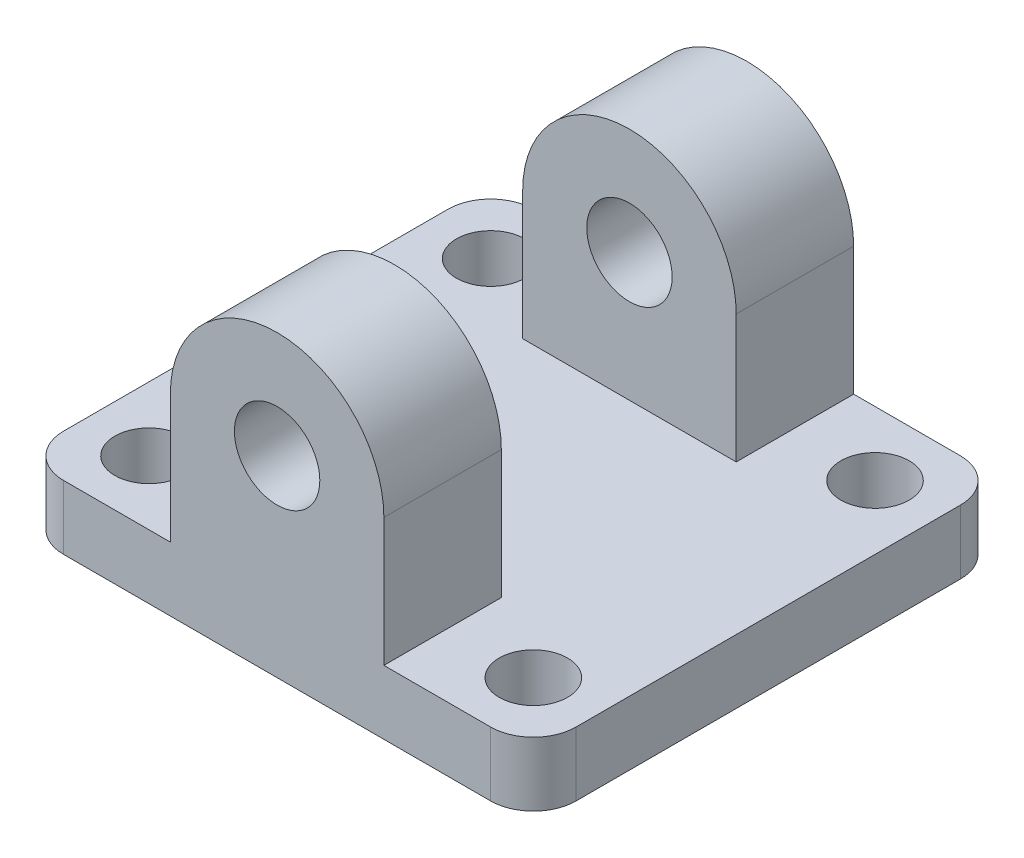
SolidWorks part; units mm, degrees
ref_plane "前视基准面" through (0, 0, 0) normal (0, 0, 1) x (1, 0, 0)
ref_plane "上视基准面" through (0, 0, 0) normal (0, 1, 0) x (1, 0, 0)
ref_plane "右视基准面" through (0, 0, 0) normal (1, 0, 0) x (0, 0, -1)
sketch "草图1" plane through (0, 0, 0) normal (0, 0, 1) x (1, 0, 0)
  line L0 (-12, 0) -> (12, 0)
  line L1 (12, 0) -> (12, 3)
  line L2 (12, 3) -> (5, 3)
  line L3 (5, 3) -> (5, 9)
  line L4 (-5, 9) -> (-5, 3)
  line L5 (-5, 3) -> (-12, 3)
  line L6 (-12, 3) -> (-12, 0)
  line L7 (0, 0) -> (0, 14) construction
  arc A0 (5, 9) -> (-5, 9) centre (0, 9) ccw
  dimension "D1" = 5
  dimension "D2" = 6
  dimension "D3" = 3
  dimension "D4" = 24
extrude "凸台-拉伸1" add sketch "草图1" along normal blind 22
sketch "草图2" plane through (0, 0, 0) normal (1, 0, 0) x (0, 0, -1)
  line L0 (-11, 14) -> (-11, 0) construction
  line L1 (0, 14) -> (-22, 14) construction
  line L2 (-22, 0) -> (0, 0) construction
  line L3 (-5.5, 14) -> (-5.5, 3)
  line L4 (-16.5, 14) -> (-16.5, 3)
  line L5 (-5.5, 14) -> (-16.5, 14)
  line L6 (-5.5, 3) -> (-16.5, 3)
  line L7 (-22, 3) -> (0, 3) construction
  dimension "D1" = 11
extrude "切除-拉伸2" cut sketch "草图2" against normal mid plane 16 contours L3 L6 L4 L5
hole_wizard "Ø4.0 (4) 直径孔2" positions "草图4" profile "草图5" hole size "Ø4.0" standard "GB"
sketch "草图4" plane through (0, 0, 22) normal (0, 0, 1) x (1, 0, 0)
  point P0 (0, 9)
sketch "草图5" plane through (0, 9, 22) normal (1, 0, 0) x (0, -1, 0)
  line L0 (0, 0) -> (0, 22)
  line L1 (0, 22) -> (2, 22)
  line L2 (2, 22) -> (2, 0)
  line L5 (2, 0) -> (0, 0)
  line L11 (0, -6.35) -> (0, 107.95) construction
  dimension "通孔孔直径" = 4
  dimension "通孔孔深度" = 22
sketch "草图12" plane through (0, 0, 0) normal (0, -1, 0) x (1, 0, 0)
  line L0 (-12, 11) -> (12, 11) construction
  line L1 (-12, 22) -> (-12, 0) construction
  line L2 (12, 22) -> (12, 0) construction
  line L3 (0, 22) -> (0, 0) construction
  line L4 (-12, 22) -> (12, 22) construction
hole_wizard "Ø3.2 (3.2) 直径孔1" positions "草图13" profile "草图14" hole size "Ø3.2" standard "GB"
sketch "草图13" plane through (0, 3, 0) normal (0, 1, 0) x (1, 0, 0)
  line L0 (-5, 0) -> (-5, -22) construction
  line L1 (0, 0) -> (0, -22) construction
  line L2 (5, 0) -> (-5, 0) construction
  line L4 (-12, -11) -> (12, -11) construction
  line L6 (-5, 0) -> (-12, 0) construction
  line L7 (-12, -22) -> (-12, 0) construction
  point P7 (-9, -3)
  point P27 (-9, -19)
  point P29 (9, -3)
  point P30 (9, -19)
  dimension "D1" = 3
  dimension "D2" = 3
sketch "草图14" plane through (9, 3, 19) normal (1, 0, 0) x (0, 0, 1)
  line L0 (0, 0) -> (0, 3)
  line L1 (0, 3) -> (1.6, 3)
  line L2 (1.6, 3) -> (1.6, 0)
  line L5 (1.6, 0) -> (0, 0)
  line L11 (0, -6.35) -> (0, 107.95) construction
  dimension "通孔孔直径" = 3.2
  dimension "通孔孔深度" = 3
fillet "圆角1" radius 2 4 edges at (12, 1.5, 0) (12, 1.5, 22) (-12, 1.5, 22) (-12, 1.5, 0)
